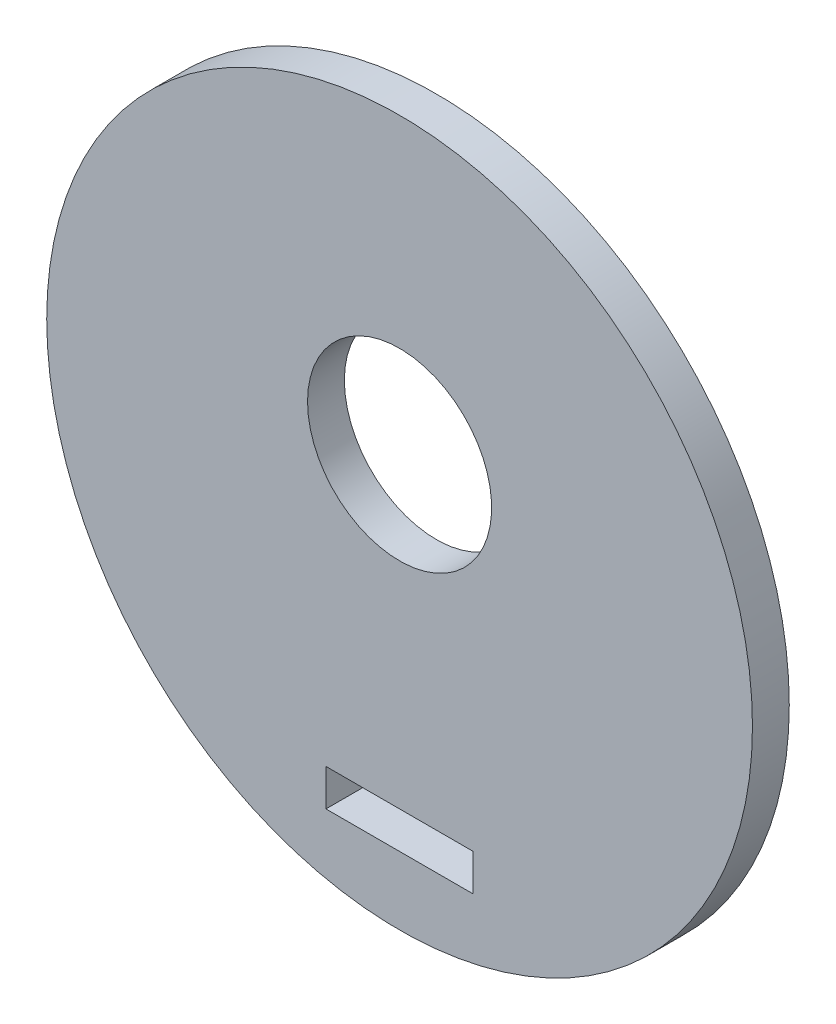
SolidWorks part; units mm, degrees
ref_plane "Front Plane" through (0, 0, 0) normal (0, 0, 1) x (1, 0, 0)
ref_plane "Top Plane" through (0, 0, 0) normal (0, 1, 0) x (1, 0, 0)
ref_plane "Right Plane" through (0, 0, 0) normal (1, 0, 0) x (0, 0, -1)
sketch "Sketch1" plane through (0, 0, 0) normal (0, 0, 1) x (1, 0, 0)
  circle A0 centre (0, 0) radius 36.5125
  dimension "D1" = 73.025
extrude "Extrude1" add sketch "Sketch1" along normal blind 3.81
sketch "Sketch2" plane through (0, 0, 0) normal (0, 0, 1) x (1, 0, 0)
  line L0 (0, -28.6592) -> (0, 27.2927) construction
  circle A0 centre (0, 6.096) radius 9.525
  dimension "D2" = 19.05
  dimension "D1" = 6.096
extrude "Cut-Extrude2" cut sketch "Sketch2" along normal through all
sketch "Sketch3" plane through (0, 0, 0) normal (0, 0, 1) x (1, 0, 0)
  line L0 (-7.62, -25.654) -> (7.62, -25.654)
  line L1 (0, 36.5125) -> (0, -36.5125) construction
  line L2 (27.6164, 0) -> (-27.6164, 0) construction
  line L3 (0, 6.096) -> (26.7534, 6.096) construction
  line L4 (0, 6.096) -> (-27.6164, 6.096) construction
  line L5 (-7.62, -25.654) -> (-7.62, -29.464)
  line L6 (-7.62, -29.464) -> (7.62, -29.464)
  line L7 (7.62, -29.464) -> (7.62, -25.654)
  circle A0 centre (0, 0) radius 36.5125 construction
  dimension "D1" = 31.75
  dimension "D2" = 15.24
  dimension "D3" = 7.62
  dimension "D4" = 3.81
extrude "Cut-Extrude3" cut sketch "Sketch3" along normal through all
